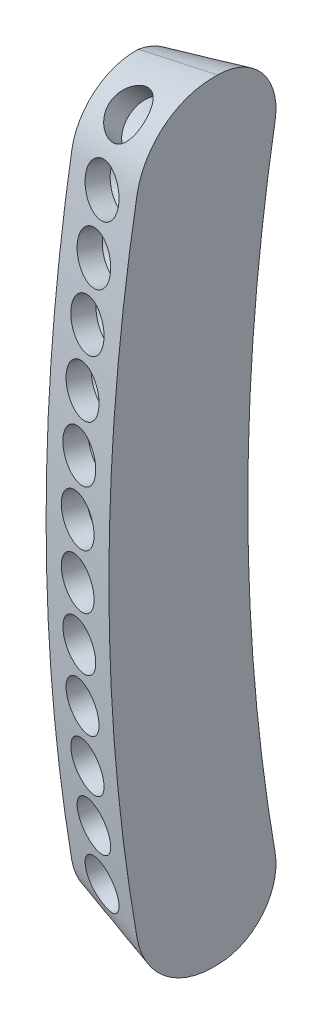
SolidWorks part; units mm, degrees
ref_plane "Ebene vorne" through (0, 0, 0) normal (0, 0, 1) x (1, 0, 0)
ref_plane "Ebene oben" through (0, 0, 0) normal (0, 1, 0) x (1, 0, 0)
ref_plane "Ebene rechts" through (0, 0, 0) normal (1, 0, 0) x (0, 0, -1)
sketch "Skizze1" plane through (0, 0, 0) normal (0, 0, 1) x (1, 0, 0)
  line L0 (-9.5, -20.8) -> (-9.5, -15.8)
  line L1 (-10, -20.8) -> (-14.8, -19.5138)
  line L2 (-10, -11.17) -> (-10, -20.8)
  line L3 (10, -20.8) -> (14.8, -19.5138)
  line L4 (9.5, -20.8) -> (9.5, -15.8)
  line L5 (10, -11.17) -> (10, -20.8)
  line L6 (0, 21) -> (0, -21) construction
  line L7 (-9.5, -20.8) -> (-10, -20.8)
  line L8 (9.5, -20.8) -> (10, -20.8)
  line L9 (10, 20.8) -> (14.8, 19.5138)
  line L10 (15.5, 0) -> (-15.5, 0) construction
  line L11 (15.5, 0) -> (-15.5, 0) construction
  line L12 (-14.8, 19.5138) -> (-14.8, 0)
  line L13 (9.5, 9.45) -> (9.5, 0)
  line L14 (-9.5, 9.45) -> (-9.5, 0)
  line L15 (-9.5, -15.8) -> (0, -15.8)
  line L16 (-10, -11.17) -> (0, -11.17)
  line L17 (-14.8, -19.5138) -> (-14.8, 0)
  line L18 (-9.5, -9.45) -> (-9.5, 0)
  line L19 (-9.5, -15.8) -> (-10, -11.17)
  line L20 (9.5, -9.45) -> (9.5, 0)
  line L21 (8.45, -10.5) -> (0, -10.5)
  line L22 (10, -11.17) -> (0, -11.17)
  line L23 (9.5, -15.8) -> (0, -15.8)
  line L24 (-8.45, -10.5) -> (0, -10.5)
  line L25 (9.5, -15.8) -> (10, -11.17)
  line L26 (-9.5, 15.8) -> (0, 15.8)
  line L27 (-10, 11.17) -> (0, 11.17)
  line L28 (-9.5, 20.8) -> (-9.5, 15.8)
  line L29 (-10, 11.17) -> (-10, 20.8)
  line L30 (-9.5, 15.8) -> (-10, 11.17)
  line L31 (-10, 20.8) -> (-14.8, 19.5138)
  line L32 (-9.5, 20.8) -> (-10, 20.8)
  line L33 (9.5, 20.8) -> (9.5, 15.8)
  line L34 (10, 11.17) -> (10, 20.8)
  line L35 (9.5, 15.8) -> (0, 15.8)
  line L36 (8.45, 10.5) -> (0, 10.5)
  line L37 (10, 11.17) -> (0, 11.17)
  line L38 (-8.45, 10.5) -> (0, 10.5)
  line L39 (9.5, 15.8) -> (10, 11.17)
  line L40 (9.5, 20.8) -> (10, 20.8)
  line L41 (14.8, 19.5138) -> (14.8, 0)
  line L42 (14.8, -19.5138) -> (14.8, 0)
  line L44 (-23.0375, 26.1997) -> (20.2752, 26.1997)
  line L45 (-23.0375, 26.1997) -> (-23.0375, -26.5435)
  line L46 (-23.0375, -26.5435) -> (20.2752, -26.5435)
  line L47 (20.2752, 26.1997) -> (20.2752, -26.5435)
  arc A0 (-9.5, -9.45) -> (-8.45, -10.5) centre (-8.45, -9.45) ccw
  arc A1 (8.45, -10.5) -> (9.5, -9.45) centre (8.45, -9.45) ccw
  arc A2 (-8.45, 10.5) -> (-9.5, 9.45) centre (-8.45, 9.45) ccw
  arc A3 (9.5, 9.45) -> (8.45, 10.5) centre (8.45, 9.45) ccw
sketch "Bohrungsprojektion" plane through (0, 0, 0) normal (0, 0, 1) x (1, 0, 0)
  line L0 (-12.485, 19.175) -> (-12.485, 1.475)
  line L1 (0, 0) -> (-24.4151, 0) construction
  line L2 (-12.485, -19.175) -> (-12.485, -1.475)
  point P2 (-12.485, 1.475)
  point P4 (-12.485, 4.425)
  point P5 (-12.485, 22.125)
  point P6 (-12.485, 25.075)
  point P7 (-12.485, 28.025)
  point P8 (-12.485, 30.975)
  point P9 (-12.485, 33.925)
  point P10 (-12.485, 36.875)
  point P11 (-12.485, 39.825)
  point P15 (-12.485, -16.225)
  point P16 (-12.485, -13.275)
  point P17 (-12.485, -10.325)
  point P18 (-12.485, 7.375)
  point P19 (-12.485, 10.325)
  point P20 (-12.485, 13.275)
  point P21 (-12.485, 16.225)
  point P22 (-12.485, 19.175)
  point P23 (-12.485, -7.375)
  point P24 (-12.485, -4.425)
  dimension "D1" = 2.95
ref_plane "R Gehäuseseite außen" through (-14.8, 0, 0) normal (1, 0, 0) x (0, 0, -1)
ref_plane "R Gehäuseseite innen" through (-10.17, 0, 0) normal (1, 0, 0) x (0, 0, -1)
sketch "Gehäuse innen" plane through (-10.17, 0, 0) normal (1, 0, 0) x (0, 0, -1)
  line L0 (0, -24.654) -> (0, 23.9963) construction
  line L2 (5.8713, 20.8) -> (5.6072, 20.8)
  line L3 (5.8713, -20.8) -> (5.6072, -20.8)
  line L4 (4.45, 1.7525) -> (4.45, -1.8112) construction
  line L7 (-5.23, 0) -> (31.9996, 0) construction
  arc A0 (8.9748, 17.111) -> (7.5, 0) centre (107.5, 0) ccw
  arc A2 (1.5203, 17.3709) -> (0, 0) centre (100, 0) ccw
  circle A3 centre (4.45, 0) radius 0.89 construction
  arc A4 (5.6072, 20.8) -> (1.5203, 17.3709) centre (5.6072, 16.65) ccw
  arc A6 (8.9748, 17.111) -> (5.8713, 20.8) centre (5.8713, 17.65) ccw
  arc A7 (7.5, 0) -> (8.9748, -17.111) centre (107.5, 0) ccw
  arc A8 (5.8713, -20.8) -> (8.9748, -17.111) centre (5.8713, -17.65) ccw
  arc A9 (1.5203, -17.3709) -> (5.6072, -20.8) centre (5.6072, -16.65) ccw
  arc A10 (0, 0) -> (1.5203, -17.3709) centre (100, 0) ccw
  point P31 (7.8457, 10.4328)
  point P32 (1.1822, 15.3309)
sketch "Skizze6" plane through (-14.8, 0, 0) normal (1, 0, 0) x (0, 0, -1)
  line L2 (-4.0978, 0) -> (10.1012, 0) construction
  line L5 (4.4, 1.7525) -> (4.4, -1.8112) construction
  line L6 (8.5561, -15.8) -> (2.311, -15.8) construction
  arc A0 (8.8545, 16.3867) -> (6.2219, 19.5138) centre (5.7046, 16.4066) ccw
  arc A1 (6.2219, 19.5138) -> (2.6271, 16.5947) centre (6.0791, 16.0168) ccw
  arc A4 (7.5, 0) -> (8.8545, -16.3867) centre (107.3, 0) ccw
  arc A5 (8.8545, 16.3867) -> (7.5, 0) centre (107.3, 0) ccw
  circle A6 centre (4.4, 0) radius 0.89 construction
  arc A8 (2.6271, 16.5947) -> (1.2406, 0) centre (101.2406, 0) ccw
  arc A9 (6.2219, -19.5138) -> (2.6271, -16.5947) centre (6.0791, -16.0168) cw
  arc A10 (8.8545, -16.3867) -> (6.2219, -19.5138) centre (5.7046, -16.4066) cw
  arc A11 (1.2406, 0) -> (2.6271, -16.5947) centre (101.2406, 0) ccw
  point P19 (7.8457, 10.4328)
  point P29 (2.0913, 13.0159)
loft "R Gehäuseseite1" add profiles "Skizze6", "Gehäuse innen"
sketch "Skizze7" plane through (-10.17, 0, 0) normal (1, 0, 0) x (0, 0, -1)
  line L0 (0, -24.654) -> (0, 23.9963) construction
  line L2 (5.8713, 20.8) -> (5.6072, 20.8)
  line L3 (5.8713, -20.8) -> (5.6072, -20.8)
  line L4 (4.45, 1.7525) -> (4.45, -1.8112) construction
  line L7 (-5.23, 0) -> (31.9996, 0) construction
  arc A1 (8.9748, 17.111) -> (7.5, 0) centre (107.5, 0) ccw
  arc A8 (1.5203, 17.3709) -> (0, 0) centre (100, 0) ccw
  circle A11 centre (4.45, 0) radius 0.89 construction
  arc A12 (5.6072, 20.8) -> (1.5203, 17.3709) centre (5.6072, 16.65) ccw
  arc A14 (8.9748, 17.111) -> (5.8713, 20.8) centre (5.8713, 17.65) ccw
  arc A15 (7.5, 0) -> (8.9748, -17.111) centre (107.5, 0) ccw
  arc A16 (5.8713, -20.8) -> (8.9748, -17.111) centre (5.8713, -17.65) ccw
  arc A17 (1.5203, -17.3709) -> (5.6072, -20.8) centre (5.6072, -16.65) ccw
  arc A18 (0, 0) -> (1.5203, -17.3709) centre (100, 0) ccw
  point P44 (7.8457, 10.4328)
  point P45 (1.1822, 15.3309)
hole_wizard "Hilfsbohrung gegen Nullkörper" positions "3D-Skizze9" profile "Skizze56" legacy
sketch3d "3D-Skizze9"
  point P0 (-12.485, 4.425, -0.7183)
  point P2 (-12.485, 1.475, -0.6312)
  point P4 (-12.485, 7.375, -0.8927)
  point P6 (-12.485, 10.325, -1.155)
  point P8 (-12.485, 13.275, -1.5057)
  point P22 (-12.485, 16.225, -1.9459)
  point P24 (-12.485, 19.175, -3.2826)
  point P31 (-12.485, -1.475, -0.6312)
  point P33 (-12.485, -4.425, -0.7183)
  point P35 (-12.485, -7.375, -0.8927)
  point P37 (-12.485, -10.325, -1.155)
  point P39 (-12.485, -13.275, -1.5057)
  point P41 (-12.485, -16.225, -1.9459)
  point P43 (-12.485, -19.175, -3.2831)
sketch "Skizze56" plane through (-12.485, 4.425, -0.7183) normal (0.6984, 0.6984, 0.1562) x (-0.6673, 0.7144, -0.2105)
  line L0 (0, 0) -> (0, 1.9972)
  line L1 (0, 1.9972) -> (1.25, 1.9972)
  line L2 (1.25, 1.9972) -> (1.25, 0)
  line L3 (1.25, 0) -> (0, 0)
  line L4 (0, 110) -> (0, -10) construction
  dimension "Durchmesser" = 2.5
  dimension "Tiefe" = 1.9972
hole_wizard "Ø2.5 (2.5) Durchmesser Bohrung9" positions "3D-Skizze10" profile "Skizze59" hole size "Ø2.5" standard "DIN"
sketch3d "3D-Skizze10"
  point P0 (-12.485, 1.475, -0.6312)
  point P4 (-12.485, 7.375, -0.8927)
  point P6 (-12.485, 10.325, -1.155)
  point P8 (-12.485, 13.275, -1.5057)
  point P10 (-12.485, 16.225, -1.9459)
  point P12 (-12.485, 4.425, -0.7183)
  point P14 (-12.485, 19.175, -3.2826)
  point P32 (-12.485, -1.475, -0.6312)
  point P34 (-12.485, -4.425, -0.7183)
  point P36 (-12.485, -7.375, -0.8927)
  point P38 (-12.485, -10.325, -1.155)
  point P40 (-12.485, -13.275, -1.5057)
  point P42 (-12.485, -16.225, -1.9459)
  point P44 (-12.485, -19.175, -3.2831)
sketch "Skizze59" plane through (-12.485, 1.475, -0.6312) normal (0.696, 0.696, 0.1762) x (0.6697, -0.7179, 0.1901)
  line L0 (0, 0) -> (0, 1.8711)
  line L1 (0, 1.8711) -> (1.25, 1.12)
  line L2 (1.25, 1.12) -> (1.25, 0)
  line L5 (1.25, 0) -> (0, 0)
  line L10 (0, 1.8711) -> (-1.25, 1.12) construction
  line L11 (0, -6.35) -> (0, 107.95) construction
  dimension "Bohrerdurchmesser" = 2.5
  dimension "Bohrungstiefe" = 1.12
  dimension "Spitzenwinkel" = 118
